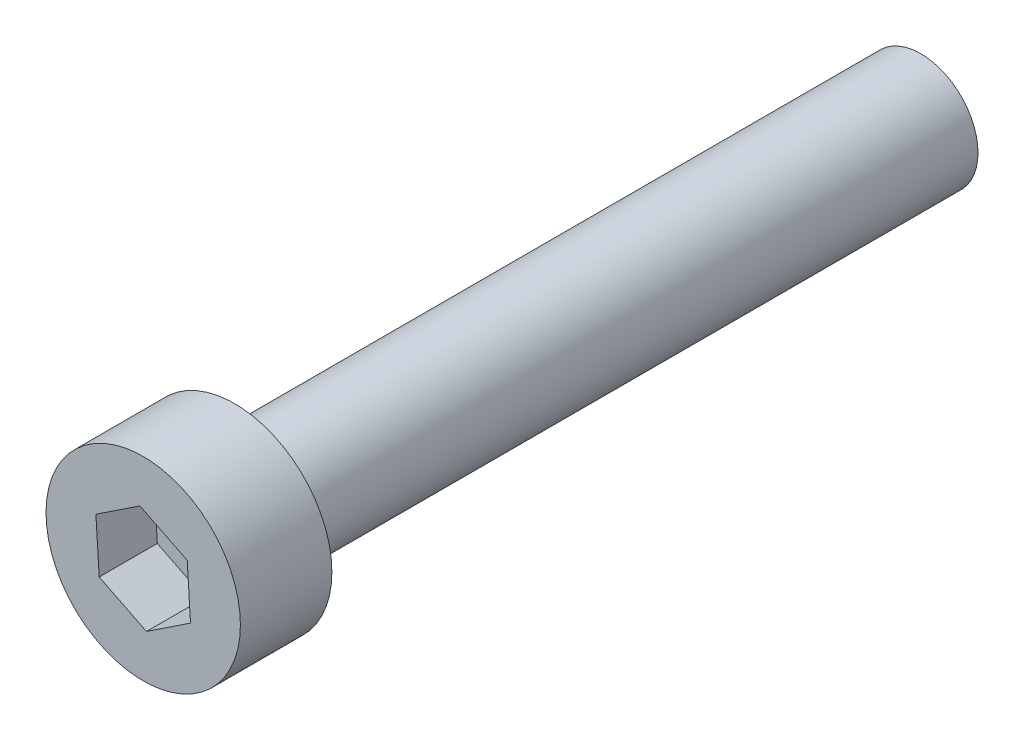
SolidWorks part; units mm, degrees
ref_plane "Front Plane" through (0, 0, 0) normal (0, 0, 1) x (1, 0, 0)
ref_plane "Top Plane" through (0, 0, 0) normal (0, 1, 0) x (1, 0, 0)
ref_plane "Right Plane" through (0, 0, 0) normal (1, 0, 0) x (0, 0, -1)
sketch "Sketch1" plane through (0, 0, 0) normal (0, 0, 1) x (1, 0, 0)
  circle A0 centre (0, 0) radius 2.5
  dimension "D1" = 5
extrude "Boss-Extrude1" add sketch "Sketch1" along normal blind 30
sketch "Sketch2" plane through (0, 0, 30) normal (0, 0, 1) x (1, 0, 0)
  circle A0 centre (0, 0) radius 4.25
  dimension "D1" = 8.5
extrude "Boss-Extrude2" add sketch "Sketch2" along normal blind 4
sketch "Sketch3" plane through (0, 0, 34) normal (0, 0, 1) x (1, 0, 0)
  line L1 (2.0681, -1.0279) -> (1.9242, 1.2771)
  line L2 (1.9242, 1.2771) -> (-0.1439, 2.3049)
  line L3 (-0.1439, 2.3049) -> (-2.0681, 1.0279)
  line L4 (-2.0681, 1.0279) -> (-1.9242, -1.2771)
  line L5 (-1.9242, -1.2771) -> (0.1439, -2.3049)
  line L6 (0.1439, -2.3049) -> (2.0681, -1.0279)
  circle A0 centre (0, 0) radius 2 construction
  dimension "D1" = 4
extrude "Cut-Extrude1" cut sketch "Sketch3" against normal blind 2.54
